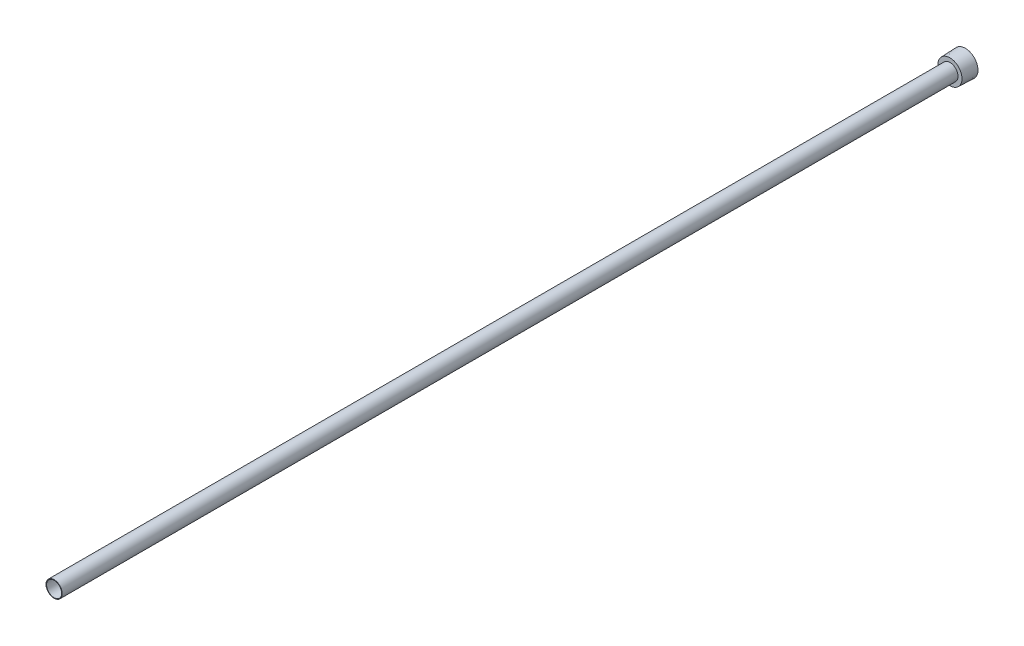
SolidWorks part; units mm, degrees
ref_plane "Front Plane" through (0, 0, 0) normal (0, 0, 1) x (1, 0, 0)
ref_plane "Top Plane" through (0, 0, 0) normal (0, 1, 0) x (1, 0, 0)
ref_plane "Right Plane" through (0, 0, 0) normal (1, 0, 0) x (0, 0, -1)
sketch "Sketch1" plane through (0, 0, 0) normal (1, 0, 0) x (0, 0, -1)
  line L0 (-168.7934, 0) -> (49831.2066, 0) construction
  line L6 (0, 0) -> (0, 8.4709)
  line L7 (0, 8.4709) -> (-10.3124, 8.0947)
  line L8 (-10.3124, 8.0947) -> (-10.3124, 5.4229)
  line L9 (-10.3124, 5.4229) -> (-609.6, 5.4229)
  line L10 (-609.6, 5.4229) -> (-609.6, 0)
  line L11 (0, 0) -> (-609.6, 0)
  dimension "D1" = 10.3124
  dimension "D2" = 16.9418
  dimension "D3" = 2.089
  dimension "D4" = 10.8458
  dimension "D5" = 609.6
revolve "Revolve1" add sketch "Sketch1" angle 360 about L0
sketch "Sketch2" plane through (0, 0, 609.6) normal (0, 0, 1) x (1, 0, 0)
  circle A0 centre (0, 0) radius 5.0419
  dimension "D1" = 10.0838
extrude "Cut-Extrude1" cut sketch "Sketch2" against normal through all
sketch "Sketch3" plane through (0, 0, 0) normal (0, 0, -1) x (-1, 0, 0)
  line L0 (0, 9.318) -> (0, -9.318) construction
  line L1 (0, -6.4158) -> (5.5562, -3.2079)
  line L2 (5.5562, -3.2079) -> (5.5562, 3.2079)
  line L3 (5.5562, 3.2079) -> (0, 6.4158)
  line L4 (0, 6.4158) -> (-5.5563, 3.2079)
  line L5 (-5.5563, 3.2079) -> (-5.5563, -3.2079)
  line L6 (-5.5563, -3.2079) -> (0, -6.4158)
  circle A0 centre (0, 0) radius 5.5563 construction
  dimension "D1" = 11.1125
extrude "Cut-Extrude2" cut sketch "Sketch3" against normal blind 6.35
